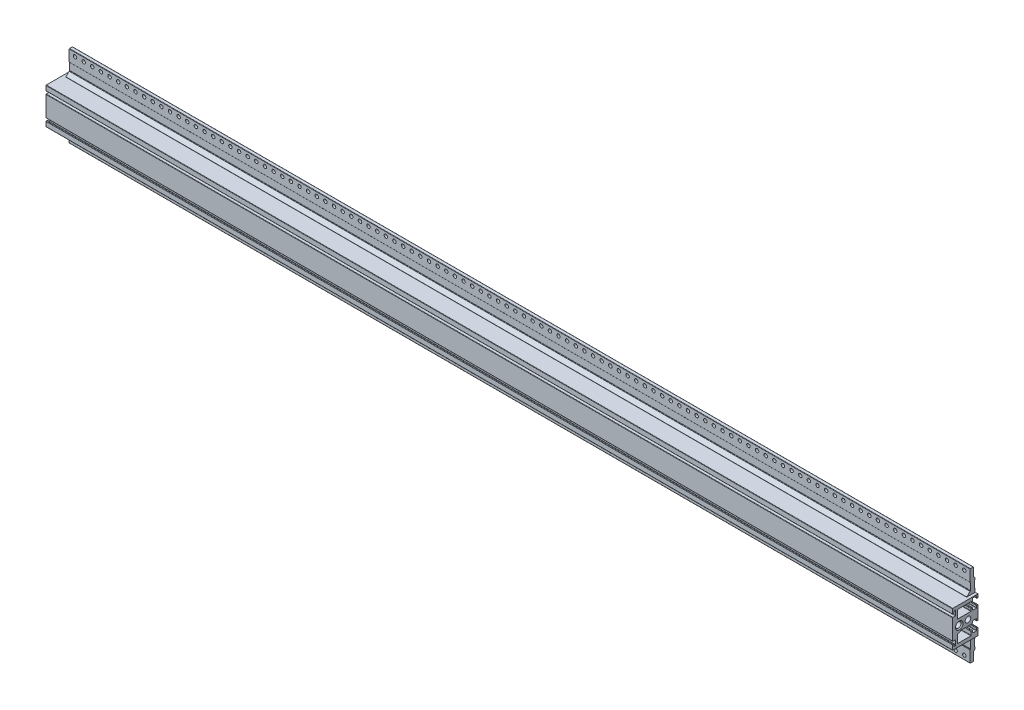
SolidWorks part; units mm, degrees
ref_plane "前视基准面" through (0, 0, 0) normal (0, 0, 1) x (1, 0, 0)
ref_plane "上视基准面" through (0, 0, 0) normal (0, 1, 0) x (1, 0, 0)
ref_plane "右视基准面" through (0, 0, 0) normal (1, 0, 0) x (0, 0, -1)
sketch "草图2" plane through (0, 0, 0) normal (1, 0, 0) x (0, 0, -1)
  line L0 (8.2, 24.1) -> (9.8, 24.1)
  line L1 (-3.8, 10.65) -> (5.9172, 10.65)
  line L2 (7.2, 5.2) -> (7.7, 5.2)
  line L3 (10.4, 5.2) -> (10.8, 5.2)
  line L4 (-1, 3.8) -> (6.8, 3.8)
  line L5 (8.1, 3.8) -> (10, 3.8)
  line L6 (8.1, 10.1) -> (10, 10.1)
  line L7 (-1, 8.7) -> (7.7, 8.7)
  line L8 (10.4, 8.7) -> (10.8, 8.7)
  line L9 (-3.8, 7.65) -> (-3.3, 7.65)
  line L10 (-2.9, 9.15) -> (-2.3, 9.15)
  line L11 (-3.8, 6.1) -> (-2.3, 6.1)
  line L12 (11, 18.0172) -> (11, 17.3)
  line L13 (11, 12.4627) -> (11, 8.9)
  line L14 (10.2, 9.9) -> (10.2, 8.9)
  line L15 (11, 5) -> (11, 1.325)
  line L16 (11, 1.025) -> (11, 0.15)
  line L17 (10.2, 9) -> (10.2, 8.9)
  line L18 (10.2, 5) -> (10.2, 4)
  line L19 (11, 0.15) -> (11, -2.65)
  line L20 (11, -6.55) -> (11, -12.45)
  line L21 (10.2, -1.65) -> (10.2, -2.65)
  line L22 (10.2, -6.55) -> (10.2, -7.55)
  line L23 (7, -6.55) -> (7, -8.5)
  line L24 (7.9, 9.9) -> (7.9, 8.9)
  line L25 (7.9, 5) -> (7.9, 4)
  line L26 (7.9, -1.65) -> (7.9, -2.65)
  line L27 (7.9, -6.55) -> (7.9, -7.55)
  line L28 (-1.2, 8.5) -> (-1.2, 4)
  line L29 (-1.2, -3.9892) -> (-1.2, -8.5)
  line L30 (11, -17.2873) -> (11, -18.0586)
  line L31 (10.7, 16.9127) -> (10.7, 12.85)
  line L32 (10.7, -12.8373) -> (10.7, -16.9)
  line L33 (10, 23.9) -> (10, 19.1828)
  line L34 (10, -19.1828) -> (10, -23.9)
  line L35 (8, 23.9) -> (8, 17.2873)
  line L36 (7, 5) -> (7, 4)
  line L38 (8.3, 16.9) -> (8.3, 12.85)
  line L39 (8.3, -12.85) -> (8.3, -16.9)
  line L40 (9.8, -24.1) -> (8.2, -24.1)
  line L41 (5.9172, -10.65) -> (-3.8, -10.65)
  line L42 (6.8, -8.7) -> (-1, -8.7)
  line L43 (10.7, -2.85) -> (10.5, -2.85)
  line L44 (11, 1.025) -> (10.85, 1.175)
  line L45 (11, 1.325) -> (10.85, 1.175)
  line L46 (10.8, -6.35) -> (10.4, -6.35)
  line L47 (7.7, -6.35) -> (7.2, -6.35)
  line L48 (10.8, -2.85) -> (10.4, -2.85)
  line L49 (7.7, -2.85) -> (1.5358, -2.85)
  line L50 (10, -1.45) -> (8.1, -1.45)
  line L51 (10, -7.75) -> (8.1, -7.75)
  line L52 (-3.3, -7.65) -> (-3.8, -7.65)
  line L53 (-2.3, -9.15) -> (-2.9, -9.15)
  line L54 (-2.3, -6.1) -> (-3.8, -6.1)
  line L55 (-4, -10.45) -> (-4, -7.85)
  line L56 (-4, -5.9) -> (-4, 5.9)
  line L57 (-4, 7.85) -> (-4, 10.45)
  line L58 (-3.1, -8.95) -> (-3.1, -7.85)
  line L59 (-3.1, 7.85) -> (-3.1, 8.95)
  line L60 (-2.1, -8.95) -> (-2.1, -6.3)
  line L61 (-2.1, 6.3) -> (-2.1, 8.95)
  line L62 (10.0586, -19.0414) -> (10.9707, -18.1293)
  line L63 (10.0586, 19.0414) -> (10.9414, 18.1586)
  line L64 (6.0586, 10.7086) -> (7.9418, 12.5918)
  line L65 (-1.0695, -3.8017) -> (1.4664, -2.8625)
  line L66 (8, -17.2873) -> (8, -23.9)
  line L68 (6.0586, -10.7086) -> (7.9418, -12.5918)
  arc A0 (8.3, 16.9) -> (8.15, 17.0936) centre (8.1, 16.9) ccw
  arc A1 (8, 17.2873) -> (8.15, 17.0936) centre (8.2, 17.2873) ccw
  arc A2 (10.85, 17.1064) -> (11, 17.3) centre (10.8, 17.3) ccw
  arc A3 (10.85, 17.1064) -> (10.7, 16.9127) centre (10.9, 16.9127) ccw
  arc A4 (5.9172, 10.65) -> (6.0586, 10.7086) centre (5.9172, 10.85) ccw
  arc A5 (-3.8, 10.65) -> (-4, 10.45) centre (-3.8, 10.45) ccw
  arc A6 (7.2, 5.2) -> (7, 5) centre (7.2, 5) ccw
  arc A7 (10.4, 5.2) -> (10.2, 5) centre (10.4, 5) ccw
  arc A8 (-1.2, 4) -> (-1, 3.8) centre (-1, 4) ccw
  arc A9 (10, 3.8) -> (10.2, 4) centre (10, 4) ccw
  arc A10 (7.9, 4) -> (8.1, 3.8) centre (8.1, 4) ccw
  arc A11 (10.2, 9.9) -> (10, 10.1) centre (10, 9.9) ccw
  arc A12 (7.7, 8.7) -> (7.9, 8.9) centre (7.7, 8.9) ccw
  arc A13 (-1, 8.7) -> (-1.2, 8.5) centre (-1, 8.5) ccw
  arc A14 (-3.3, 7.65) -> (-3.1, 7.85) centre (-3.3, 7.85) ccw
  arc A15 (-2.9, 9.15) -> (-3.1, 8.95) centre (-2.9, 8.95) ccw
  arc A16 (-2.3, 6.1) -> (-2.1, 6.3) centre (-2.3, 6.3) ccw
  arc A17 (8.0916, 12.6502) -> (8.3, 12.85) centre (8.1, 12.85) ccw
  arc A18 (8.0916, 12.6502) -> (7.9418, 12.5918) centre (8.0832, 12.4504) ccw
  arc A19 (10.7, 12.85) -> (10.85, 12.6564) centre (10.9, 12.85) ccw
  arc A20 (11, 12.4627) -> (10.85, 12.6564) centre (10.8, 12.4627) ccw
  arc A21 (11, 18.0172) -> (10.9414, 18.1586) centre (10.8, 18.0172) ccw
  arc A22 (10.8, 8.7) -> (11, 8.9) centre (10.8, 8.9) ccw
  arc A23 (11, 5) -> (10.8, 5.2) centre (10.8, 5) ccw
  arc A24 (10.2, 8.9) -> (10.4, 8.7) centre (10.4, 8.9) ccw
  arc A25 (10.2, -2.65) -> (10.4, -2.85) centre (10.4, -2.65) ccw
  arc A26 (10.4, -6.35) -> (10.2, -6.55) centre (10.4, -6.55) ccw
  arc A27 (7.2, -6.35) -> (7, -6.55) centre (7.2, -6.55) ccw
  arc A28 (6.8, -8.7) -> (7, -8.5) centre (6.8, -8.5) ccw
  arc A29 (8.1, 10.1) -> (7.9, 9.9) centre (8.1, 9.9) ccw
  arc A30 (7.9, 5) -> (7.7, 5.2) centre (7.7, 5) ccw
  arc A31 (8.1, -1.45) -> (7.9, -1.65) centre (8.1, -1.65) ccw
  arc A32 (7.9, -6.55) -> (7.7, -6.35) centre (7.7, -6.55) ccw
  arc A33 (7.9, -7.55) -> (8.1, -7.75) centre (8.1, -7.55) ccw
  arc A34 (-1.0695, -3.8017) -> (-1.2, -3.9892) centre (-1, -3.9892) ccw
  arc A35 (10, 23.9) -> (9.8, 24.1) centre (9.8, 23.9) ccw
  arc A36 (9.8, -24.1) -> (10, -23.9) centre (9.8, -23.9) ccw
  arc A37 (10.0586, -19.0414) -> (10, -19.1828) centre (10.2, -19.1828) ccw
  arc A38 (8.2, 24.1) -> (8, 23.9) centre (8.2, 23.9) ccw
  arc A39 (6.8, 3.8) -> (7, 4) centre (6.8, 4) ccw
  arc A40 (8, -23.9) -> (8.2, -24.1) centre (8.2, -23.9) ccw
  arc A41 (10.7, -16.9) -> (10.85, -17.0936) centre (10.9, -16.9) ccw
  arc A42 (11, -17.2873) -> (10.85, -17.0936) centre (10.8, -17.2873) ccw
  arc A43 (8.15, -17.0936) -> (8.3, -16.9) centre (8.1, -16.9) ccw
  arc A44 (8.15, -17.0936) -> (8, -17.2873) centre (8.2, -17.2873) ccw
  arc A45 (-4, -10.45) -> (-3.8, -10.65) centre (-3.8, -10.45) ccw
  arc A46 (-1.2, -8.5) -> (-1, -8.7) centre (-1, -8.5) ccw
  arc A47 (11, -6.55) -> (10.8, -6.35) centre (10.8, -6.55) ccw
  arc A48 (10.8, -2.85) -> (11, -2.65) centre (10.8, -2.65) ccw
  arc A49 (7.7, -2.85) -> (7.9, -2.65) centre (7.7, -2.65) ccw
  arc A50 (10.2, -1.65) -> (10, -1.45) centre (10, -1.65) ccw
  arc A51 (10, -7.75) -> (10.2, -7.55) centre (10, -7.55) ccw
  arc A52 (-3.1, -7.85) -> (-3.3, -7.65) centre (-3.3, -7.85) ccw
  arc A53 (-2.3, -9.15) -> (-2.1, -8.95) centre (-2.3, -8.95) ccw
  arc A54 (-2.1, -6.3) -> (-2.3, -6.1) centre (-2.3, -6.3) ccw
  arc A55 (10.85, -12.6436) -> (11, -12.45) centre (10.8, -12.45) ccw
  arc A56 (10.85, -12.6436) -> (10.7, -12.8373) centre (10.9, -12.8373) ccw
  arc A57 (-3.8, -7.65) -> (-4, -7.85) centre (-3.8, -7.85) ccw
  arc A58 (-4, -5.9) -> (-3.8, -6.1) centre (-3.8, -5.9) ccw
  arc A59 (-3.8, 6.1) -> (-4, 5.9) centre (-3.8, 5.9) ccw
  arc A60 (-4, 7.85) -> (-3.8, 7.65) centre (-3.8, 7.85) ccw
  arc A61 (-3.1, -8.95) -> (-2.9, -9.15) centre (-2.9, -8.95) ccw
  arc A62 (-2.1, 8.95) -> (-2.3, 9.15) centre (-2.3, 8.95) ccw
  arc A63 (10.9707, -18.1293) -> (11, -18.0586) centre (10.9, -18.0586) ccw
  arc A64 (10, 19.1828) -> (10.0586, 19.0414) centre (10.2, 19.1828) ccw
  arc A65 (1.5358, -2.85) -> (1.4664, -2.8625) centre (1.5358, -3.05) ccw
  circle A66 centre (0, 0) radius 1.6
  arc A70 (5.9172, -10.65) -> (6.0586, -10.7086) centre (5.9172, -10.85) cw
  arc A71 (8.0916, -12.6502) -> (7.9418, -12.5918) centre (8.0832, -12.4504) cw
  arc A72 (8.0916, -12.6502) -> (8.3, -12.85) centre (8.1, -12.85) cw
extrude "凸台-拉伸1" add sketch "草图2" along normal mid plane 431.8
sketch "草图3" plane through (0, 0, 4) normal (0, 0, 1) x (1, 0, 0)
  line L0 (215.9, -10.65) -> (-215.9, -10.65) construction
  line L1 (215.9, -24.1) -> (214.25, -24.1)
  line L2 (215.9, -24.1) -> (215.9, -10.65)
  line L3 (215.9, -10.65) -> (214.25, -10.65)
  line L4 (214.25, -24.1) -> (214.25, -10.65)
  line L6 (0, 0) -> (0, -44.0064) construction
  line L8 (215.9, 24.1) -> (214.25, 24.1)
  line L9 (215.9, 24.1) -> (215.9, 10.65)
  line L10 (215.9, 10.65) -> (214.25, 10.65)
  line L11 (214.25, 24.1) -> (214.25, 10.65)
  line L12 (215.9, 10.65) -> (-215.9, 10.65) construction
  line L13 (-214.25, 24.1) -> (-214.25, 10.65)
  line L14 (-215.9, 10.65) -> (-214.25, 10.65)
  line L15 (-215.9, 24.1) -> (-215.9, 10.65)
  line L16 (-215.9, 24.1) -> (-214.25, 24.1)
  line L17 (-214.25, -24.1) -> (-214.25, -10.65)
  line L18 (-215.9, -10.65) -> (-214.25, -10.65)
  line L19 (-215.9, -24.1) -> (-215.9, -10.65)
  line L20 (-215.9, -24.1) -> (-214.25, -24.1)
  dimension "D1" = 1.65
extrude "切除-拉伸1" cut sketch "草图3" against normal through all
sketch "草图4" plane through (0, 0, -10) normal (0, 0, -1) x (-1, 0, 0)
  line L0 (-215.9, 10.65) -> (-215.9, 8.9) construction
  line L2 (-214.25, 24.1) -> (-234.25, 24.1) construction
  line L3 (-214.25, -24.1) -> (-234.25, -24.1) construction
  line L4 (-224.25, 24.1) -> (-224.25, -24.1) construction
  line L5 (-224.25, 0) -> (-201.0943, 0) construction
  circle A0 centre (-210.82, 21.65) radius 0.75
  circle A1 centre (-210.82, -21.65) radius 0.75
  circle A2 centre (-205.74, 21.65) radius 0.75
  circle A3 centre (-205.74, -21.65) radius 0.75
  circle A4 centre (-200.66, 21.65) radius 0.75
  circle A5 centre (-200.66, -21.65) radius 0.75
  circle A6 centre (-195.58, 21.65) radius 0.75
  circle A7 centre (-195.58, -21.65) radius 0.75
  circle A8 centre (-190.5, 21.65) radius 0.75
  circle A9 centre (-190.5, -21.65) radius 0.75
  circle A10 centre (-185.42, 21.65) radius 0.75
  circle A11 centre (-185.42, -21.65) radius 0.75
  circle A12 centre (-180.34, 21.65) radius 0.75
  circle A13 centre (-180.34, -21.65) radius 0.75
  circle A14 centre (-175.26, 21.65) radius 0.75
  circle A15 centre (-175.26, -21.65) radius 0.75
  circle A16 centre (-170.18, 21.65) radius 0.75
  circle A17 centre (-170.18, -21.65) radius 0.75
  circle A18 centre (-165.1, 21.65) radius 0.75
  circle A19 centre (-165.1, -21.65) radius 0.75
  circle A20 centre (-160.02, 21.65) radius 0.75
  circle A21 centre (-160.02, -21.65) radius 0.75
  circle A22 centre (-154.94, 21.65) radius 0.75
  circle A23 centre (-154.94, -21.65) radius 0.75
  circle A24 centre (-149.86, 21.65) radius 0.75
  circle A25 centre (-149.86, -21.65) radius 0.75
  circle A26 centre (-144.78, 21.65) radius 0.75
  circle A27 centre (-144.78, -21.65) radius 0.75
  circle A28 centre (-139.7, 21.65) radius 0.75
  circle A29 centre (-139.7, -21.65) radius 0.75
  circle A30 centre (-134.62, 21.65) radius 0.75
  circle A31 centre (-134.62, -21.65) radius 0.75
  circle A32 centre (-129.54, 21.65) radius 0.75
  circle A33 centre (-129.54, -21.65) radius 0.75
  circle A34 centre (-124.46, 21.65) radius 0.75
  circle A35 centre (-124.46, -21.65) radius 0.75
  circle A36 centre (-119.38, 21.65) radius 0.75
  circle A37 centre (-119.38, -21.65) radius 0.75
  circle A38 centre (-114.3, 21.65) radius 0.75
  circle A39 centre (-114.3, -21.65) radius 0.75
  circle A40 centre (-109.22, 21.65) radius 0.75
  circle A41 centre (-109.22, -21.65) radius 0.75
  circle A42 centre (-104.14, 21.65) radius 0.75
  circle A43 centre (-104.14, -21.65) radius 0.75
  circle A44 centre (-99.06, 21.65) radius 0.75
  circle A45 centre (-99.06, -21.65) radius 0.75
  circle A46 centre (-93.98, 21.65) radius 0.75
  circle A47 centre (-93.98, -21.65) radius 0.75
  circle A48 centre (-88.9, 21.65) radius 0.75
  circle A49 centre (-88.9, -21.65) radius 0.75
  circle A50 centre (-83.82, 21.65) radius 0.75
  circle A51 centre (-83.82, -21.65) radius 0.75
  circle A52 centre (-78.74, 21.65) radius 0.75
  circle A53 centre (-78.74, -21.65) radius 0.75
  circle A54 centre (-73.66, 21.65) radius 0.75
  circle A55 centre (-73.66, -21.65) radius 0.75
  circle A56 centre (-68.58, 21.65) radius 0.75
  circle A57 centre (-68.58, -21.65) radius 0.75
  circle A58 centre (-63.5, 21.65) radius 0.75
  circle A59 centre (-63.5, -21.65) radius 0.75
  circle A60 centre (-58.42, 21.65) radius 0.75
  circle A61 centre (-58.42, -21.65) radius 0.75
  circle A62 centre (-53.34, 21.65) radius 0.75
  circle A63 centre (-53.34, -21.65) radius 0.75
  circle A64 centre (-48.26, 21.65) radius 0.75
  circle A65 centre (-48.26, -21.65) radius 0.75
  circle A66 centre (-43.18, 21.65) radius 0.75
  circle A67 centre (-43.18, -21.65) radius 0.75
  circle A68 centre (-38.1, 21.65) radius 0.75
  circle A69 centre (-38.1, -21.65) radius 0.75
  circle A70 centre (-33.02, 21.65) radius 0.75
  circle A71 centre (-33.02, -21.65) radius 0.75
  circle A72 centre (-27.94, 21.65) radius 0.75
  circle A73 centre (-27.94, -21.65) radius 0.75
  circle A74 centre (-22.86, 21.65) radius 0.75
  circle A75 centre (-22.86, -21.65) radius 0.75
  circle A76 centre (-17.78, 21.65) radius 0.75
  circle A77 centre (-17.78, -21.65) radius 0.75
  circle A78 centre (-12.7, 21.65) radius 0.75
  circle A79 centre (-12.7, -21.65) radius 0.75
  circle A80 centre (-7.62, 21.65) radius 0.75
  circle A81 centre (-7.62, -21.65) radius 0.75
  circle A82 centre (-2.54, 21.65) radius 0.75
  circle A83 centre (-2.54, -21.65) radius 0.75
  circle A84 centre (2.54, 21.65) radius 0.75
  circle A85 centre (2.54, -21.65) radius 0.75
  circle A86 centre (7.62, 21.65) radius 0.75
  circle A87 centre (7.62, -21.65) radius 0.75
  circle A88 centre (12.7, 21.65) radius 0.75
  circle A89 centre (12.7, -21.65) radius 0.75
  circle A90 centre (17.78, 21.65) radius 0.75
  circle A91 centre (17.78, -21.65) radius 0.75
  circle A92 centre (22.86, 21.65) radius 0.75
  circle A93 centre (22.86, -21.65) radius 0.75
  circle A94 centre (27.94, 21.65) radius 0.75
  circle A95 centre (27.94, -21.65) radius 0.75
  circle A96 centre (33.02, 21.65) radius 0.75
  circle A97 centre (33.02, -21.65) radius 0.75
  circle A98 centre (38.1, 21.65) radius 0.75
  circle A99 centre (38.1, -21.65) radius 0.75
  circle A100 centre (43.18, 21.65) radius 0.75
  circle A101 centre (43.18, -21.65) radius 0.75
  circle A102 centre (48.26, 21.65) radius 0.75
  circle A103 centre (48.26, -21.65) radius 0.75
  circle A104 centre (53.34, 21.65) radius 0.75
  circle A105 centre (53.34, -21.65) radius 0.75
  circle A106 centre (58.42, 21.65) radius 0.75
  circle A107 centre (58.42, -21.65) radius 0.75
  circle A108 centre (63.5, 21.65) radius 0.75
  circle A109 centre (63.5, -21.65) radius 0.75
  circle A110 centre (68.58, 21.65) radius 0.75
  circle A111 centre (68.58, -21.65) radius 0.75
  circle A112 centre (73.66, 21.65) radius 0.75
  circle A113 centre (73.66, -21.65) radius 0.75
  circle A114 centre (78.74, 21.65) radius 0.75
  circle A115 centre (78.74, -21.65) radius 0.75
  circle A116 centre (83.82, 21.65) radius 0.75
  circle A117 centre (83.82, -21.65) radius 0.75
  circle A118 centre (88.9, 21.65) radius 0.75
  circle A119 centre (88.9, -21.65) radius 0.75
  circle A120 centre (93.98, 21.65) radius 0.75
  circle A121 centre (93.98, -21.65) radius 0.75
  circle A122 centre (99.06, 21.65) radius 0.75
  circle A123 centre (99.06, -21.65) radius 0.75
  circle A124 centre (104.14, 21.65) radius 0.75
  circle A125 centre (104.14, -21.65) radius 0.75
  circle A126 centre (109.22, 21.65) radius 0.75
  circle A127 centre (109.22, -21.65) radius 0.75
  circle A128 centre (114.3, 21.65) radius 0.75
  circle A129 centre (114.3, -21.65) radius 0.75
  circle A130 centre (119.38, 21.65) radius 0.75
  circle A131 centre (119.38, -21.65) radius 0.75
  circle A132 centre (124.46, 21.65) radius 0.75
  circle A133 centre (124.46, -21.65) radius 0.75
  circle A134 centre (129.54, 21.65) radius 0.75
  circle A135 centre (129.54, -21.65) radius 0.75
  circle A136 centre (134.62, 21.65) radius 0.75
  circle A137 centre (134.62, -21.65) radius 0.75
  circle A138 centre (139.7, 21.65) radius 0.75
  circle A139 centre (139.7, -21.65) radius 0.75
  circle A140 centre (144.78, 21.65) radius 0.75
  circle A141 centre (144.78, -21.65) radius 0.75
  circle A142 centre (149.86, 21.65) radius 0.75
  circle A143 centre (149.86, -21.65) radius 0.75
  circle A144 centre (154.94, 21.65) radius 0.75
  circle A145 centre (154.94, -21.65) radius 0.75
  circle A146 centre (160.02, 21.65) radius 0.75
  circle A147 centre (160.02, -21.65) radius 0.75
  circle A148 centre (165.1, 21.65) radius 0.75
  circle A149 centre (165.1, -21.65) radius 0.75
  circle A150 centre (170.18, 21.65) radius 0.75
  circle A151 centre (170.18, -21.65) radius 0.75
  circle A152 centre (175.26, 21.65) radius 0.75
  circle A153 centre (175.26, -21.65) radius 0.75
  circle A154 centre (180.34, 21.65) radius 0.75
  circle A155 centre (180.34, -21.65) radius 0.75
  circle A156 centre (185.42, 21.65) radius 0.75
  circle A157 centre (185.42, -21.65) radius 0.75
  circle A158 centre (190.5, 21.65) radius 0.75
  circle A159 centre (190.5, -21.65) radius 0.75
  circle A160 centre (195.58, 21.65) radius 0.75
  circle A161 centre (195.58, -21.65) radius 0.75
  circle A162 centre (200.66, 21.65) radius 0.75
  circle A163 centre (200.66, -21.65) radius 0.75
  circle A164 centre (205.74, 21.65) radius 0.75
  circle A165 centre (205.74, -21.65) radius 0.75
  circle A166 centre (210.82, 21.65) radius 0.75
  circle A167 centre (210.82, -21.65) radius 0.75
  dimension "D1" = 1.5
  dimension "D2" = 5.08
  dimension "D3" = 20
  dimension "D4" = 43.3
  dimension "D6" = 5.08
  dimension "D5" = 84
extrude "切除-拉伸2" cut sketch "草图4" against normal through all
hole_wizard "M2.5 螺纹孔1" positions "3D草图1" profile "草图5" tap size "M2.5" standard "Gb"
sketch3d "3D草图1"
  line L0 (210.82, 21.65, -8) -> (210.82, 21.65, -10) construction
  line L1 (210.82, -21.65, -8) -> (210.82, -21.65, -10) construction
  point P0 (210.82, 21.65, -10)
  point P4 (210.82, -21.65, -10)
sketch "草图5" plane through (210.82, 21.65, -10) normal (1, 0, 0) x (0, 1, 0)
  line L0 (0, 0) -> (0, 14)
  line L1 (0, 14) -> (1.025, 14)
  line L2 (1.025, 14) -> (1.025, 0)
  line L5 (1.025, 0) -> (0, 0)
  line L11 (0, -6.35) -> (0, 107.95) construction
  dimension "通孔螺纹孔钻头直径" = 2.05
  dimension "通孔螺纹孔钻头深度" = 14
pattern_linear "阵列(线性)1" count 84 spacing 5.08 along (-1, 0, 0) of "M2.5 螺纹孔1"
hole_wizard "M4 螺纹孔1" positions "3D草图2" profile "草图6" tap size "M4" standard "Gb"
sketch3d "3D草图2"
  line L0 (215.9, 0, 0) -> (-215.9, 0, 0) construction
  point P0 (0, 0, 0)
  point P4 (-215.9, 0, 0)
  point P8 (215.9, 0, 0)
sketch "草图6" plane through (-215.9, 0, 0) normal (0, 1, 0) x (0, 0, 1)
  line L0 (0, 0) -> (0, 15.0914)
  line L1 (0, 15.0914) -> (1.65, 14.1)
  line L2 (1.65, 14.1) -> (1.65, 0)
  line L5 (1.65, 0) -> (0, 0)
  line L10 (0, 15.0914) -> (-1.65, 14.1) construction
  line L11 (0, -6.35) -> (0, 107.95) construction
  dimension "螺纹孔钻头直径" = 3.3
  dimension "螺纹孔钻头深度" = 14.1
  dimension "导头角度" = 118
chamfer "倒角1" distance 0.6 angle 45 2 edges at (215.9, 0, -1.65) (-215.9, 0, 1.65)
sketch "草图7" plane through (-215.9, 0, 0) normal (-1, 0, 0) x (0, 0, 1)
  circle A0 centre (-5.1, 0.5) radius 1.65
  circle A1 centre (0, 0) radius 1.65 construction
  circle A2 centre (0, 0) radius 2.25 construction
  dimension "D1" = 5.1
  dimension "D2" = 0.5
  dimension "D3" = 3.3
extrude "切除-拉伸3" cut sketch "草图7" against normal blind 20
sketch "草图8" plane through (-214.25, 0, 0) normal (-1, 0, 0) x (0, 0, 1)
  line L0 (-5.8819, -10.65) -> (-8, -10.65)
  line L1 (-11, -10.65) -> (3.8, -10.65) construction
  line L2 (-11, -10.65) -> (-5.9172, -10.65) construction
  line L3 (-8, -10.65) -> (-8, -13.2407)
  line L4 (-8, -13.2407) -> (-5.8819, -10.65)
  line L5 (-11, -12.45) -> (-11, -10.65) construction
  dimension "D1" = 3
extrude "切除-拉伸4" cut sketch "草图8" against normal through all
fillet "圆角1" radius 0.2 2 edges at (0, -12.6322, -8) (0, -10.65, -8)
sketch "草图9" plane through (215.9, 0, 0) normal (1, 0, 0) x (0, 0, -1)
  circle A0 centre (5.1, 0.5) radius 1.65
  circle A1 centre (0, 0) radius 2.25 construction
  dimension "D1" = 3.3
  dimension "D2" = 5.1
  dimension "D3" = 0.5
extrude "切除-拉伸5" cut sketch "草图9" against normal blind 20
sketch "草图10" plane through (-215.9, 0, 0) normal (-1, 0, 0) x (0, 0, 1)
  line L1 (-14.6587, 24.9072) -> (8.2982, 24.9072)
  line L2 (-14.6587, 24.9072) -> (-14.6587, -27.0814)
  line L3 (-14.6587, -27.0814) -> (8.2982, -27.0814)
  line L4 (8.2982, 24.9072) -> (8.2982, -27.0814)
extrude "切除-拉伸6" cut sketch "草图10" against normal blind 22
sketch "草图11" plane through (-193.9, 0, 0) normal (-1, 0, 0) x (0, 0, 1)
  line L64 (-8, -12.4627) -> (-8, -10.85)
  line L65 (-7.8, -10.65) -> (3.8, -10.65)
  line L66 (4, -10.45) -> (4, -7.85)
  line L67 (3.8, -7.65) -> (3.3, -7.65)
  line L68 (3.1, -7.85) -> (3.1, -8.95)
  line L69 (2.9, -9.15) -> (2.3, -9.15)
  line L70 (2.1, -8.95) -> (2.1, -6.3)
  line L71 (2.3, -6.1) -> (3.8, -6.1)
  line L72 (4, -5.9) -> (4, 5.9)
  line L73 (3.8, 6.1) -> (2.3, 6.1)
  line L74 (2.1, 6.3) -> (2.1, 8.95)
  line L75 (2.3, 9.15) -> (2.9, 9.15)
  line L76 (3.1, 8.95) -> (3.1, 7.85)
  line L77 (3.3, 7.65) -> (3.8, 7.65)
  line L78 (4, 7.85) -> (4, 10.45)
  line L79 (3.8, 10.65) -> (-5.9172, 10.65)
  line L80 (-6.0586, 10.7086) -> (-7.9418, 12.5918)
  line L81 (-8.3, 12.85) -> (-8.3, 16.9)
  line L82 (-8, 17.2873) -> (-8, 23.9)
  line L83 (-8.2, 24.1) -> (-9.8, 24.1)
  line L84 (-10, 23.9) -> (-10, 19.1828)
  line L85 (-10.0586, 19.0414) -> (-10.9414, 18.1586)
  line L86 (-11, 18.0172) -> (-11, 17.3)
  line L87 (-10.7, 16.9127) -> (-10.7, 12.85)
  line L88 (-11, 12.4627) -> (-11, 8.9)
  line L89 (-10.8, 8.7) -> (-10.4, 8.7)
  line L90 (-10.2, 8.9) -> (-10.2, 9.9)
  line L91 (-10, 10.1) -> (-8.1, 10.1)
  line L92 (-7.9, 9.9) -> (-7.9, 8.9)
  line L93 (-7.7, 8.7) -> (1, 8.7)
  line L94 (1.2, 8.5) -> (1.2, 4)
  line L95 (1, 3.8) -> (-6.8, 3.8)
  line L96 (-7, 4) -> (-7, 5)
  line L97 (-7.2, 5.2) -> (-7.7, 5.2)
  line L98 (-7.9, 5) -> (-7.9, 4)
  line L99 (-8.1, 3.8) -> (-10, 3.8)
  line L100 (-10.2, 4) -> (-10.2, 5)
  line L101 (-10.4, 5.2) -> (-10.8, 5.2)
  line L102 (-11, 5) -> (-11, 1.325)
  line L103 (-11, 1.325) -> (-10.85, 1.175)
  line L104 (-10.85, 1.175) -> (-11, 1.025)
  line L105 (-11, 1.025) -> (-11, -2.65)
  line L106 (-10.8, -2.85) -> (-10.4, -2.85)
  line L107 (-10.2, -2.65) -> (-10.2, -1.65)
  line L108 (-10, -1.45) -> (-8.1, -1.45)
  line L109 (-7.9, -1.65) -> (-7.9, -2.65)
  line L110 (-7.7, -2.85) -> (-1.5358, -2.85)
  line L111 (-1.4664, -2.8625) -> (1.0695, -3.8017)
  line L112 (1.2, -3.9892) -> (1.2, -8.5)
  line L113 (1, -8.7) -> (-6.8, -8.7)
  line L114 (-7, -8.5) -> (-7, -6.55)
  line L115 (-7.2, -6.35) -> (-7.7, -6.35)
  line L116 (-7.9, -6.55) -> (-7.9, -7.55)
  line L117 (-8.1, -7.75) -> (-10, -7.75)
  line L118 (-10.2, -7.55) -> (-10.2, -6.55)
  line L119 (-10.4, -6.35) -> (-10.8, -6.35)
  line L120 (-11, -6.55) -> (-11, -12.45)
  line L121 (-10.7, -12.8373) -> (-10.7, -16.9)
  line L122 (-11, -17.2873) -> (-11, -18.0586)
  line L123 (-10.9707, -18.1293) -> (-10.0586, -19.0414)
  line L124 (-10, -19.1828) -> (-10, -23.9)
  line L125 (-9.8, -24.1) -> (-8.2, -24.1)
  line L126 (-8, -23.9) -> (-8, -17.2873)
  line L127 (-8.3, -16.9) -> (-8.3, -12.85)
  line L128 (-8, -12.4627) -> (-8, -10.85)
  line L129 (-7.8, -10.65) -> (3.8, -10.65)
  line L130 (4, -10.45) -> (4, -7.85)
  line L131 (3.8, -7.65) -> (3.3, -7.65)
  line L132 (3.1, -7.85) -> (3.1, -8.95)
  line L133 (2.9, -9.15) -> (2.3, -9.15)
  line L134 (2.1, -8.95) -> (2.1, -6.3)
  line L135 (2.3, -6.1) -> (3.8, -6.1)
  line L136 (4, -5.9) -> (4, 5.9)
  line L137 (3.8, 6.1) -> (2.3, 6.1)
  line L138 (2.1, 6.3) -> (2.1, 8.95)
  line L139 (2.3, 9.15) -> (2.9, 9.15)
  line L140 (3.1, 8.95) -> (3.1, 7.85)
  line L141 (3.3, 7.65) -> (3.8, 7.65)
  line L142 (4, 7.85) -> (4, 10.45)
  line L143 (3.8, 10.65) -> (-5.9172, 10.65)
  line L144 (-6.0586, 10.7086) -> (-7.9418, 12.5918)
  line L145 (-8.3, 12.85) -> (-8.3, 16.9)
  line L146 (-8, 17.2873) -> (-8, 23.9)
  line L147 (-8.2, 24.1) -> (-9.8, 24.1)
  line L148 (-10, 23.9) -> (-10, 19.1828)
  line L149 (-10.0586, 19.0414) -> (-10.9414, 18.1586)
  line L150 (-11, 18.0172) -> (-11, 17.3)
  line L151 (-10.7, 16.9127) -> (-10.7, 12.85)
  line L152 (-11, 12.4627) -> (-11, 8.9)
  line L153 (-10.8, 8.7) -> (-10.4, 8.7)
  line L154 (-10.2, 8.9) -> (-10.2, 9.9)
  line L155 (-10, 10.1) -> (-8.1, 10.1)
  line L156 (-7.9, 9.9) -> (-7.9, 8.9)
  line L157 (-7.7, 8.7) -> (1, 8.7)
  line L158 (1.2, 8.5) -> (1.2, 4)
  line L159 (1, 3.8) -> (-6.8, 3.8)
  line L160 (-7, 4) -> (-7, 5)
  line L161 (-7.2, 5.2) -> (-7.7, 5.2)
  line L162 (-7.9, 5) -> (-7.9, 4)
  line L163 (-8.1, 3.8) -> (-10, 3.8)
  line L164 (-10.2, 4) -> (-10.2, 5)
  line L165 (-10.4, 5.2) -> (-10.8, 5.2)
  line L166 (-11, 5) -> (-11, 1.325)
  line L167 (-11, 1.325) -> (-10.85, 1.175)
  line L168 (-10.85, 1.175) -> (-11, 1.025)
  line L169 (-11, 1.025) -> (-11, -2.65)
  line L170 (-10.8, -2.85) -> (-10.4, -2.85)
  line L171 (-10.2, -2.65) -> (-10.2, -1.65)
  line L172 (-10, -1.45) -> (-8.1, -1.45)
  line L173 (-7.9, -1.65) -> (-7.9, -2.65)
  line L174 (-7.7, -2.85) -> (-1.5358, -2.85)
  line L175 (-1.4664, -2.8625) -> (1.0695, -3.8017)
  line L176 (1.2, -3.9892) -> (1.2, -8.5)
  line L177 (1, -8.7) -> (-6.8, -8.7)
  line L178 (-7, -8.5) -> (-7, -6.55)
  line L179 (-7.2, -6.35) -> (-7.7, -6.35)
  line L180 (-7.9, -6.55) -> (-7.9, -7.55)
  line L181 (-8.1, -7.75) -> (-10, -7.75)
  line L182 (-10.2, -7.55) -> (-10.2, -6.55)
  line L183 (-10.4, -6.35) -> (-10.8, -6.35)
  line L184 (-11, -6.55) -> (-11, -12.45)
  line L185 (-10.7, -12.8373) -> (-10.7, -16.9)
  line L186 (-11, -17.2873) -> (-11, -18.0586)
  line L187 (-10.9707, -18.1293) -> (-10.0586, -19.0414)
  line L188 (-10, -19.1828) -> (-10, -23.9)
  line L189 (-9.8, -24.1) -> (-8.2, -24.1)
  line L190 (-8, -23.9) -> (-8, -17.2873)
  line L191 (-8.3, -16.9) -> (-8.3, -12.85)
  circle A0 centre (0, 0) radius 1.6 construction
  circle A1 centre (0, 0) radius 1.6
  arc A69 (-7.8, -10.65) -> (-8, -10.85) centre (-7.8, -10.85) ccw
  arc A70 (3.8, -10.65) -> (4, -10.45) centre (3.8, -10.45) ccw
  arc A71 (4, -7.85) -> (3.8, -7.65) centre (3.8, -7.85) ccw
  arc A72 (3.3, -7.65) -> (3.1, -7.85) centre (3.3, -7.85) ccw
  arc A73 (2.9, -9.15) -> (3.1, -8.95) centre (2.9, -8.95) ccw
  arc A74 (2.1, -8.95) -> (2.3, -9.15) centre (2.3, -8.95) ccw
  arc A75 (2.3, -6.1) -> (2.1, -6.3) centre (2.3, -6.3) ccw
  arc A76 (3.8, -6.1) -> (4, -5.9) centre (3.8, -5.9) ccw
  arc A77 (4, 5.9) -> (3.8, 6.1) centre (3.8, 5.9) ccw
  arc A78 (2.1, 6.3) -> (2.3, 6.1) centre (2.3, 6.3) ccw
  arc A79 (2.3, 9.15) -> (2.1, 8.95) centre (2.3, 8.95) ccw
  arc A80 (3.1, 8.95) -> (2.9, 9.15) centre (2.9, 8.95) ccw
  arc A81 (3.1, 7.85) -> (3.3, 7.65) centre (3.3, 7.85) ccw
  arc A82 (3.8, 7.65) -> (4, 7.85) centre (3.8, 7.85) ccw
  arc A83 (4, 10.45) -> (3.8, 10.65) centre (3.8, 10.45) ccw
  arc A84 (-6.0586, 10.7086) -> (-5.9172, 10.65) centre (-5.9172, 10.85) ccw
  arc A85 (-7.9418, 12.5918) -> (-8.0916, 12.6502) centre (-8.0832, 12.4504) ccw
  arc A86 (-8.3, 12.85) -> (-8.0916, 12.6502) centre (-8.1, 12.85) ccw
  arc A87 (-8.15, 17.0936) -> (-8.3, 16.9) centre (-8.1, 16.9) ccw
  arc A88 (-8.15, 17.0936) -> (-8, 17.2873) centre (-8.2, 17.2873) ccw
  arc A89 (-8, 23.9) -> (-8.2, 24.1) centre (-8.2, 23.9) ccw
  arc A90 (-9.8, 24.1) -> (-10, 23.9) centre (-9.8, 23.9) ccw
  arc A91 (-10.0586, 19.0414) -> (-10, 19.1828) centre (-10.2, 19.1828) ccw
  arc A92 (-10.9414, 18.1586) -> (-11, 18.0172) centre (-10.8, 18.0172) ccw
  arc A93 (-11, 17.3) -> (-10.85, 17.1064) centre (-10.8, 17.3) ccw
  arc A94 (-10.7, 16.9127) -> (-10.85, 17.1064) centre (-10.9, 16.9127) ccw
  arc A95 (-10.85, 12.6564) -> (-10.7, 12.85) centre (-10.9, 12.85) ccw
  arc A96 (-10.85, 12.6564) -> (-11, 12.4627) centre (-10.8, 12.4627) ccw
  arc A97 (-11, 8.9) -> (-10.8, 8.7) centre (-10.8, 8.9) ccw
  arc A98 (-10.4, 8.7) -> (-10.2, 8.9) centre (-10.4, 8.9) ccw
  arc A99 (-10, 10.1) -> (-10.2, 9.9) centre (-10, 9.9) ccw
  arc A100 (-7.9, 9.9) -> (-8.1, 10.1) centre (-8.1, 9.9) ccw
  arc A101 (-7.9, 8.9) -> (-7.7, 8.7) centre (-7.7, 8.9) ccw
  arc A102 (1.2, 8.5) -> (1, 8.7) centre (1, 8.5) ccw
  arc A103 (1, 3.8) -> (1.2, 4) centre (1, 4) ccw
  arc A104 (-7, 4) -> (-6.8, 3.8) centre (-6.8, 4) ccw
  arc A105 (-7, 5) -> (-7.2, 5.2) centre (-7.2, 5) ccw
  arc A106 (-7.7, 5.2) -> (-7.9, 5) centre (-7.7, 5) ccw
  arc A107 (-8.1, 3.8) -> (-7.9, 4) centre (-8.1, 4) ccw
  arc A108 (-10.2, 4) -> (-10, 3.8) centre (-10, 4) ccw
  arc A109 (-10.2, 5) -> (-10.4, 5.2) centre (-10.4, 5) ccw
  arc A110 (-10.8, 5.2) -> (-11, 5) centre (-10.8, 5) ccw
  arc A111 (-11, -2.65) -> (-10.8, -2.85) centre (-10.8, -2.65) ccw
  arc A112 (-10.4, -2.85) -> (-10.2, -2.65) centre (-10.4, -2.65) ccw
  arc A113 (-10, -1.45) -> (-10.2, -1.65) centre (-10, -1.65) ccw
  arc A114 (-7.9, -1.65) -> (-8.1, -1.45) centre (-8.1, -1.65) ccw
  arc A115 (-7.9, -2.65) -> (-7.7, -2.85) centre (-7.7, -2.65) ccw
  arc A116 (-1.4664, -2.8625) -> (-1.5358, -2.85) centre (-1.5358, -3.05) ccw
  arc A117 (1.2, -3.9892) -> (1.0695, -3.8017) centre (1, -3.9892) ccw
  arc A118 (1, -8.7) -> (1.2, -8.5) centre (1, -8.5) ccw
  arc A119 (-7, -8.5) -> (-6.8, -8.7) centre (-6.8, -8.5) ccw
  arc A120 (-7, -6.55) -> (-7.2, -6.35) centre (-7.2, -6.55) ccw
  arc A121 (-7.7, -6.35) -> (-7.9, -6.55) centre (-7.7, -6.55) ccw
  arc A122 (-8.1, -7.75) -> (-7.9, -7.55) centre (-8.1, -7.55) ccw
  arc A123 (-10.2, -7.55) -> (-10, -7.75) centre (-10, -7.55) ccw
  arc A124 (-10.2, -6.55) -> (-10.4, -6.35) centre (-10.4, -6.55) ccw
  arc A125 (-10.8, -6.35) -> (-11, -6.55) centre (-10.8, -6.55) ccw
  arc A126 (-11, -12.45) -> (-10.85, -12.6436) centre (-10.8, -12.45) ccw
  arc A127 (-10.7, -12.8373) -> (-10.85, -12.6436) centre (-10.9, -12.8373) ccw
  arc A128 (-10.85, -17.0936) -> (-10.7, -16.9) centre (-10.9, -16.9) ccw
  arc A129 (-10.85, -17.0936) -> (-11, -17.2873) centre (-10.8, -17.2873) ccw
  arc A130 (-11, -18.0586) -> (-10.9707, -18.1293) centre (-10.9, -18.0586) ccw
  arc A131 (-10, -19.1828) -> (-10.0586, -19.0414) centre (-10.2, -19.1828) ccw
  arc A132 (-10, -23.9) -> (-9.8, -24.1) centre (-9.8, -23.9) ccw
  arc A133 (-8.2, -24.1) -> (-8, -23.9) centre (-8.2, -23.9) ccw
  arc A134 (-8, -17.2873) -> (-8.15, -17.0936) centre (-8.2, -17.2873) ccw
  arc A135 (-8.3, -16.9) -> (-8.15, -17.0936) centre (-8.1, -16.9) ccw
  arc A136 (-8.15, -12.6564) -> (-8.3, -12.85) centre (-8.1, -12.85) ccw
  arc A137 (-8.15, -12.6564) -> (-8, -12.4627) centre (-8.2, -12.4627) ccw
  arc A138 (-7.8, -10.65) -> (-8, -10.85) centre (-7.8, -10.85) ccw
  arc A139 (3.8, -10.65) -> (4, -10.45) centre (3.8, -10.45) ccw
  arc A140 (4, -7.85) -> (3.8, -7.65) centre (3.8, -7.85) ccw
  arc A141 (3.3, -7.65) -> (3.1, -7.85) centre (3.3, -7.85) ccw
  arc A142 (2.9, -9.15) -> (3.1, -8.95) centre (2.9, -8.95) ccw
  arc A143 (2.1, -8.95) -> (2.3, -9.15) centre (2.3, -8.95) ccw
  arc A144 (2.3, -6.1) -> (2.1, -6.3) centre (2.3, -6.3) ccw
  arc A145 (3.8, -6.1) -> (4, -5.9) centre (3.8, -5.9) ccw
  arc A146 (4, 5.9) -> (3.8, 6.1) centre (3.8, 5.9) ccw
  arc A147 (2.1, 6.3) -> (2.3, 6.1) centre (2.3, 6.3) ccw
  arc A148 (2.3, 9.15) -> (2.1, 8.95) centre (2.3, 8.95) ccw
  arc A149 (3.1, 8.95) -> (2.9, 9.15) centre (2.9, 8.95) ccw
  arc A150 (3.1, 7.85) -> (3.3, 7.65) centre (3.3, 7.85) ccw
  arc A151 (3.8, 7.65) -> (4, 7.85) centre (3.8, 7.85) ccw
  arc A152 (4, 10.45) -> (3.8, 10.65) centre (3.8, 10.45) ccw
  arc A153 (-6.0586, 10.7086) -> (-5.9172, 10.65) centre (-5.9172, 10.85) ccw
  arc A154 (-7.9418, 12.5918) -> (-8.0916, 12.6502) centre (-8.0832, 12.4504) ccw
  arc A155 (-8.3, 12.85) -> (-8.0916, 12.6502) centre (-8.1, 12.85) ccw
  arc A156 (-8.15, 17.0936) -> (-8.3, 16.9) centre (-8.1, 16.9) ccw
  arc A157 (-8.15, 17.0936) -> (-8, 17.2873) centre (-8.2, 17.2873) ccw
  arc A158 (-8, 23.9) -> (-8.2, 24.1) centre (-8.2, 23.9) ccw
  arc A159 (-9.8, 24.1) -> (-10, 23.9) centre (-9.8, 23.9) ccw
  arc A160 (-10.0586, 19.0414) -> (-10, 19.1828) centre (-10.2, 19.1828) ccw
  arc A161 (-10.9414, 18.1586) -> (-11, 18.0172) centre (-10.8, 18.0172) ccw
  arc A162 (-11, 17.3) -> (-10.85, 17.1064) centre (-10.8, 17.3) ccw
  arc A163 (-10.7, 16.9127) -> (-10.85, 17.1064) centre (-10.9, 16.9127) ccw
  arc A164 (-10.85, 12.6564) -> (-10.7, 12.85) centre (-10.9, 12.85) ccw
  arc A165 (-10.85, 12.6564) -> (-11, 12.4627) centre (-10.8, 12.4627) ccw
  arc A166 (-11, 8.9) -> (-10.8, 8.7) centre (-10.8, 8.9) ccw
  arc A167 (-10.4, 8.7) -> (-10.2, 8.9) centre (-10.4, 8.9) ccw
  arc A168 (-10, 10.1) -> (-10.2, 9.9) centre (-10, 9.9) ccw
  arc A169 (-7.9, 9.9) -> (-8.1, 10.1) centre (-8.1, 9.9) ccw
  arc A170 (-7.9, 8.9) -> (-7.7, 8.7) centre (-7.7, 8.9) ccw
  arc A171 (1.2, 8.5) -> (1, 8.7) centre (1, 8.5) ccw
  arc A172 (1, 3.8) -> (1.2, 4) centre (1, 4) ccw
  arc A173 (-7, 4) -> (-6.8, 3.8) centre (-6.8, 4) ccw
  arc A174 (-7, 5) -> (-7.2, 5.2) centre (-7.2, 5) ccw
  arc A175 (-7.7, 5.2) -> (-7.9, 5) centre (-7.7, 5) ccw
  arc A176 (-8.1, 3.8) -> (-7.9, 4) centre (-8.1, 4) ccw
  arc A177 (-10.2, 4) -> (-10, 3.8) centre (-10, 4) ccw
  arc A178 (-10.2, 5) -> (-10.4, 5.2) centre (-10.4, 5) ccw
  arc A179 (-10.8, 5.2) -> (-11, 5) centre (-10.8, 5) ccw
  arc A180 (-11, -2.65) -> (-10.8, -2.85) centre (-10.8, -2.65) ccw
  arc A181 (-10.4, -2.85) -> (-10.2, -2.65) centre (-10.4, -2.65) ccw
  arc A182 (-10, -1.45) -> (-10.2, -1.65) centre (-10, -1.65) ccw
  arc A183 (-7.9, -1.65) -> (-8.1, -1.45) centre (-8.1, -1.65) ccw
  arc A184 (-7.9, -2.65) -> (-7.7, -2.85) centre (-7.7, -2.65) ccw
  arc A185 (-1.4664, -2.8625) -> (-1.5358, -2.85) centre (-1.5358, -3.05) ccw
  arc A186 (1.2, -3.9892) -> (1.0695, -3.8017) centre (1, -3.9892) ccw
  arc A187 (1, -8.7) -> (1.2, -8.5) centre (1, -8.5) ccw
  arc A188 (-7, -8.5) -> (-6.8, -8.7) centre (-6.8, -8.5) ccw
  arc A189 (-7, -6.55) -> (-7.2, -6.35) centre (-7.2, -6.55) ccw
  arc A190 (-7.7, -6.35) -> (-7.9, -6.55) centre (-7.7, -6.55) ccw
  arc A191 (-8.1, -7.75) -> (-7.9, -7.55) centre (-8.1, -7.55) ccw
  arc A192 (-10.2, -7.55) -> (-10, -7.75) centre (-10, -7.55) ccw
  arc A193 (-10.2, -6.55) -> (-10.4, -6.35) centre (-10.4, -6.55) ccw
  arc A194 (-10.8, -6.35) -> (-11, -6.55) centre (-10.8, -6.55) ccw
  arc A195 (-11, -12.45) -> (-10.85, -12.6436) centre (-10.8, -12.45) ccw
  arc A196 (-10.7, -12.8373) -> (-10.85, -12.6436) centre (-10.9, -12.8373) ccw
  arc A197 (-10.85, -17.0936) -> (-10.7, -16.9) centre (-10.9, -16.9) ccw
  arc A198 (-10.85, -17.0936) -> (-11, -17.2873) centre (-10.8, -17.2873) ccw
  arc A199 (-11, -18.0586) -> (-10.9707, -18.1293) centre (-10.9, -18.0586) ccw
  arc A200 (-10, -19.1828) -> (-10.0586, -19.0414) centre (-10.2, -19.1828) ccw
  arc A201 (-10, -23.9) -> (-9.8, -24.1) centre (-9.8, -23.9) ccw
  arc A202 (-8.2, -24.1) -> (-8, -23.9) centre (-8.2, -23.9) ccw
  arc A203 (-8, -17.2873) -> (-8.15, -17.0936) centre (-8.2, -17.2873) ccw
  arc A204 (-8.3, -16.9) -> (-8.15, -17.0936) centre (-8.1, -16.9) ccw
  arc A205 (-8.15, -12.6564) -> (-8.3, -12.85) centre (-8.1, -12.85) ccw
  arc A206 (-8.15, -12.6564) -> (-8, -12.4627) centre (-8.2, -12.4627) ccw
  dimension "D1" = 0
extrude "凸台-拉伸2" add sketch "草图11" along normal blind 123.6
sketch "草图12" plane through (-317.5, 0, 0) normal (-1, 0, 0) x (0, 0, 1)
  circle A0 centre (-5.1, 0.5) radius 1.65
extrude "切除-拉伸7" cut sketch "草图12" against normal blind 20
hole_wizard "M4 螺纹孔2" positions "草图15" profile "草图14" tap size "M4" standard "GB"
sketch "草图15" plane through (-317.5, 0, 0) normal (-1, 0, 0) x (0, 0, 1)
  point P0 (0, 0)
sketch "草图14" plane through (-317.5, 0, 0) normal (0, 1, 0) x (0, 0, 1)
  line L0 (0, 0) -> (0, 15.7914)
  line L1 (0, 15.7914) -> (1.65, 14.8)
  line L2 (1.65, 14.8) -> (1.65, 0)
  line L5 (1.65, 0) -> (0, 0)
  line L10 (0, 15.7914) -> (-1.65, 14.8) construction
  line L11 (0, -6.35) -> (0, 107.95) construction
  dimension "螺纹孔钻头直径" = 3.3
  dimension "螺纹孔钻头深度" = 14.8
  dimension "导头角度" = 118
sketch "草图16" plane through (-317.5, 0, 0) normal (-1, 0, 0) x (0, 0, 1)
  circle A0 centre (0, 0) radius 2
extrude "切除-拉伸8" cut sketch "草图16" against normal blind 0.6
chamfer "倒角2" distance 0.5 distance2 0.6 1 edges at (-317.5, 0, 2)
hole_wizard "M2.5 螺纹孔2" positions "草图20" profile "草图18" tap size "M2.5" standard "GB"
sketch "草图20" plane through (0, 0, -8) normal (0, 0, 1) x (1, 0, 0)
  line L0 (214.25, 24.1) -> (-317.5, 24.1) construction
  line L1 (214.25, -24.1) -> (-317.5, -24.1) construction
  circle A0 centre (-190.5, 21.65) radius 1.025 construction
  circle A2 centre (-190.5, -21.65) radius 1.025 construction
  point P0 (-195.58, 21.65)
  point P4 (-195.58, -21.65)
  dimension "D2" = 2.45
  dimension "D1" = 5.08
  dimension "D3" = 5.08
  dimension "D4" = 2.45
sketch "草图18" plane through (-195.58, 21.65, -8) normal (1, 0, 0) x (0, -1, 0)
  line L0 (0, 0) -> (0, 7.8659)
  line L1 (0, 7.8659) -> (1.025, 7.25)
  line L2 (1.025, 7.25) -> (1.025, 0)
  line L5 (1.025, 0) -> (0, 0)
  line L10 (0, 7.8659) -> (-1.025, 7.25) construction
  line L11 (0, -6.35) -> (0, 107.95) construction
  dimension "螺纹孔钻头直径" = 2.05
  dimension "螺纹孔钻头深度" = 7.25
  dimension "导头角度" = 118
pattern_linear "阵列(线性)2" count 24 spacing 5.08 along (-1, 0, 0) of "M2.5 螺纹孔2"
sketch "草图21" plane through (0, 0, 4) normal (0, 0, 1) x (1, 0, 0)
  line L5 (-317.5, 24.1) -> (-315.85, 24.1)
  line L6 (-317.5, 24.1) -> (-317.5, 10.65)
  line L7 (-317.5, 10.65) -> (-315.85, 10.65)
  line L8 (-315.85, 24.1) -> (-315.85, 10.65)
  line L9 (-317.5, -24.1) -> (-315.85, -24.1)
  line L10 (-317.5, -24.1) -> (-317.5, -10.65)
  line L11 (-317.5, -10.65) -> (-315.85, -10.65)
  line L12 (-315.85, -24.1) -> (-315.85, -10.65)
  dimension "D1" = 1.65
  dimension "D2" = 13.45
  dimension "D3" = 13.45
  dimension "D4" = 1.65
extrude "切除-拉伸9" cut sketch "草图21" against normal blind 22
